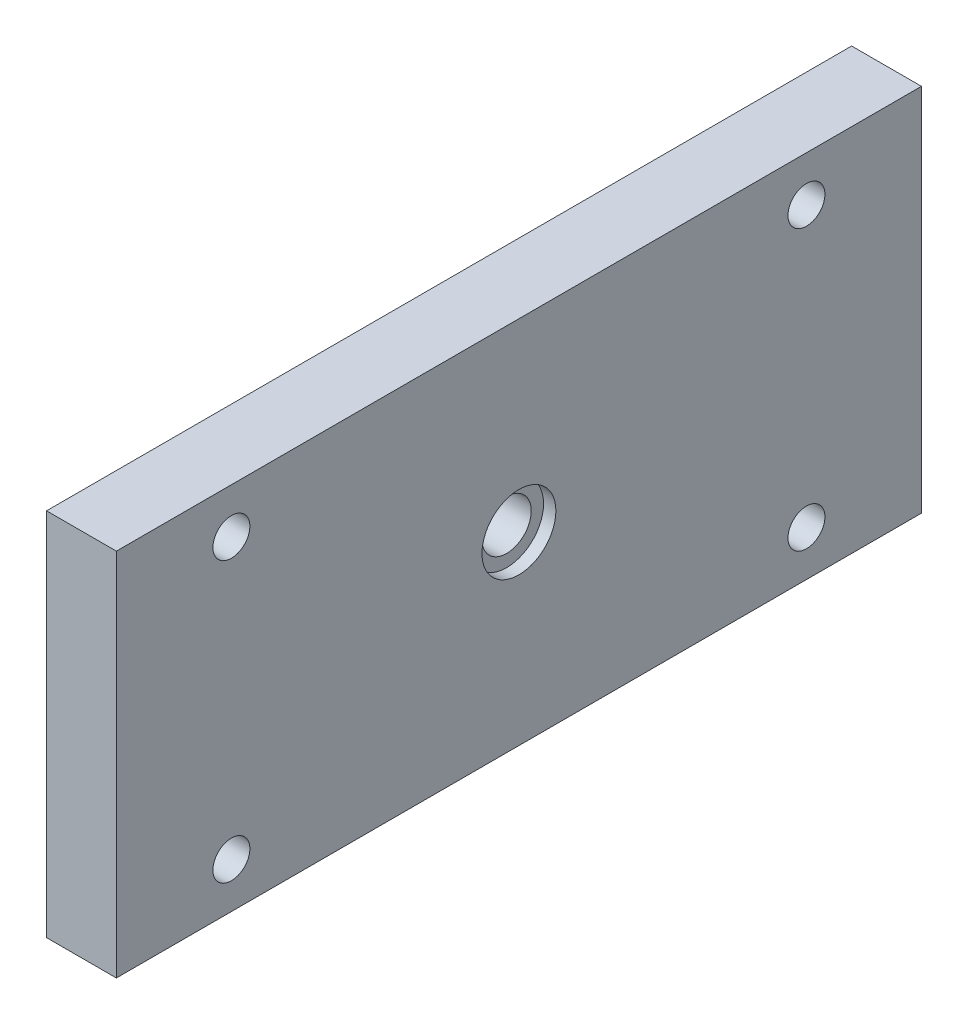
SolidWorks part; units mm, degrees
ref_plane "Face" through (0, 0, 0) normal (0, 0, 1) x (1, 0, 0)
ref_plane "Dessus" through (0, 0, 0) normal (0, 1, 0) x (1, 0, 0)
ref_plane "Droite" through (0, 0, 0) normal (1, 0, 0) x (0, 0, -1)
imported_body "Importée1"
sketch "Esquisse1" plane through (-145, 0, 0) normal (-1, 0, 0) x (0, 0, 1)
  line L0 (0, 33) -> (0, 123) construction
  line L1 (196, 33) -> (0, 33) construction
  circle A0 centre (98, 78) radius 6
  dimension "D1" = 12
  dimension "D2" = 98
  dimension "D3" = 45
extrude "Enlèv. mat.-Extru.1" cut sketch "Esquisse1" against normal through all
sketch "Esquisse2" plane through (-128, 0, 0) normal (1, 0, 0) x (0, 0, -1)
  circle A0 centre (-98, 78) radius 9
  dimension "D1" = 18
extrude "Enlèv. mat.-Extru.2" cut sketch "Esquisse2" against normal blind 3
